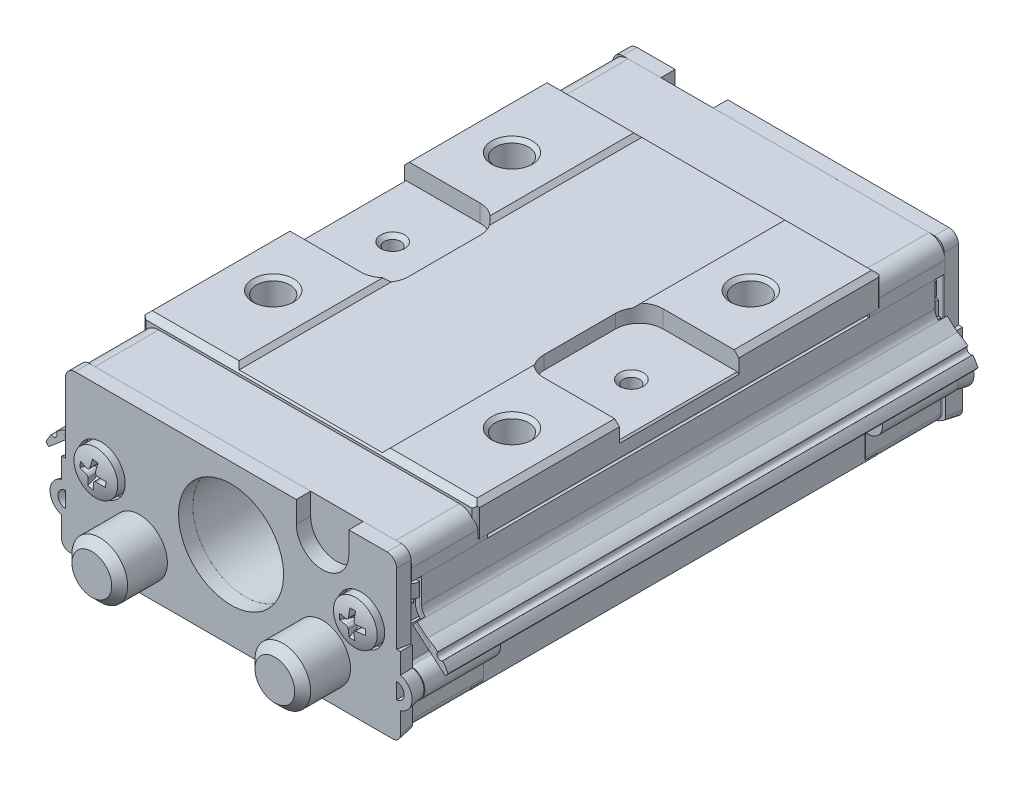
SolidWorks part; units mm, degrees
other "KKR60-FS-P_W-1-solid16"
other "KKR60-FS-P_W-1-solid12"
other "KKR60-FS-P_W-1-solid5"
other "KKR60-FS-P_W-1-solid1"
other "KKR60-FS-P_W-1-solid6"
other "KKR60-FS-P_W-1-solid11"
other "KKR60-FS-P_W-1-solid18"
other "KKR60-FS-P_W-1-solid9"
other "KKR60-FS-P_W-1-solid15"
other "KKR60-FS-P_W-1-solid13"
other "KKR60-FS-P_W-1-solid19"
other "KKR60-FS-P_W-1-solid17"
other "KKR60-FS-P_W-1-solid7"
other "KKR60-FS-P_W-1-solid8"
other "KKR60-FS-P_W-1-solid14"
other "KKR60-FS-P_W-1-solid4"
ref_plane "前视基准面" through (0, 0, 0) normal (0, 0, 1) x (1, 0, 0)
ref_plane "上视基准面" through (0, 0, 0) normal (0, 1, 0) x (1, 0, 0)
ref_plane "右视基准面" through (0, 0, 0) normal (1, 0, 0) x (0, 0, -1)
imported_body "输入1"
imported_body "输入3"
imported_body "输入4"
imported_body "输入5"
imported_body "输入6"
imported_body "输入9"
imported_body "输入11"
imported_body "输入14"
imported_body "输入15"
imported_body "输入16"
imported_body "输入18"
imported_body "输入20"
imported_body "输入22"
imported_body "输入23"
imported_body "输入24"
imported_body "输入25"
imported_body "输入27"
sketch "草图1" plane through (20.9, 0, 0) normal (1, 0, 0) x (0, 0, -1)
  line L0 (-137.2, 30) -> (-127.7, 30) construction
  line L1 (-134.9853, 30) -> (-131.0972, 30)
  line L2 (-134.9853, 30) -> (-134.9853, 28.5)
  line L3 (-134.9853, 28.5) -> (-131.0972, 28.5)
  line L4 (-131.0972, 30) -> (-131.0972, 28.5)
  line L5 (-137.2, 28.5) -> (-127.7, 28.5) construction
extrude "切除-拉伸1" cut sketch "草图1" along normal blind 10
sketch "草图2" plane through (-20.9, 0, 0) normal (-1, 0, 0) x (0, 0, 1)
  line L0 (70.2, 30) -> (79.7, 30) construction
  line L1 (72.1574, 30) -> (77.4574, 30)
  line L2 (72.1574, 30) -> (72.1574, 28.5)
  line L3 (72.1574, 28.5) -> (77.4574, 28.5)
  line L4 (77.4574, 30) -> (77.4574, 28.5)
  line L5 (70.2, 28.5) -> (79.7, 28.5) construction
extrude "切除-拉伸3" cut sketch "草图2" along normal through all
sketch "草图3" plane through (0, 0, 137.2) normal (0, 0, 1) x (1, 0, 0)
  circle A0 centre (0, 23) radius 6.6 construction
  circle A1 centre (0, 23) radius 6.6
extrude "切除-拉伸4" cut sketch "草图3" against normal through all
